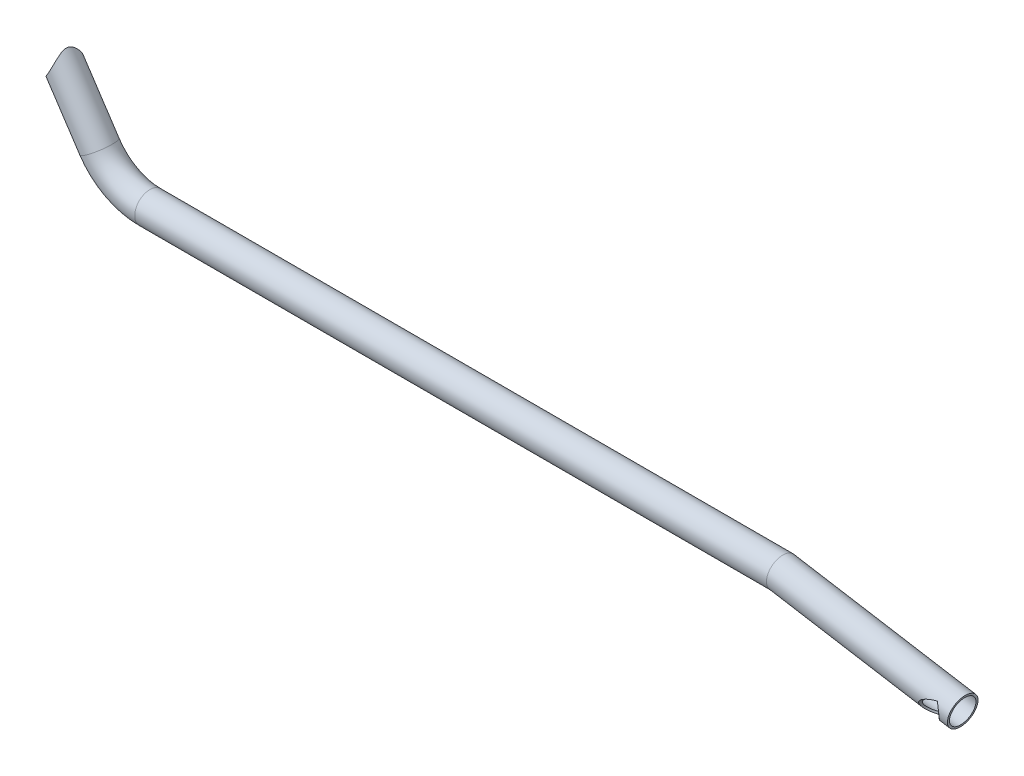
SolidWorks part; units mm, degrees
ref_plane "Plan de face" through (0, 0, 0) normal (0, 0, 1) x (1, 0, 0)
ref_plane "Plan de dessus" through (0, 0, 0) normal (0, 1, 0) x (1, 0, 0)
ref_plane "Plan de droite" through (0, 0, 0) normal (1, 0, 0) x (0, 0, -1)
sketch "Esquisse1" plane through (0, 0, 0) normal (0, 0, 1) x (1, 0, 0)
  line L0 (-442.83, 0) -> (-397.792, -68.0982)
  line L1 (-347.7469, -95) -> (280, -95)
  line L2 (280, -95) -> (460, -125)
  arc A1 (-397.792, -68.0982) -> (-347.7469, -95) centre (-347.7469, -35) ccw
  point P7 (-380, -95)
  dimension "D6" = 442.83
  dimension "D7" = 60
  dimension "D1" = 380
  dimension "D2" = 95
  dimension "D3" = 280
  dimension "D4" = 180
  dimension "D5" = 125
ref_plane "Plan1" through (460, -125, 0) normal (0.9864, -0.1644, 0) x (0, 0, -1)
sketch "Esquisse2" plane through (460, -125, 0) normal (0.9864, -0.1644, 0) x (0, 0, -1)
  circle A0 centre (0, 0) radius 15
  circle A1 centre (0, 0) radius 13
  dimension "D1" = 26
  dimension "D2" = 30
sweep "Balayage1" add profiles "Esquisse2" path "Esquisse1"
sketch "Esquisse3" plane through (-24.3152, -3.2825, 27.9414) normal (-0.6539, -0.0883, 0.7514) x (0.7564, -0.0534, 0.6519)
  circle A0 centre (355.0908, -136.5572) radius 15 construction
  circle A1 centre (355.0908, -136.5572) radius 15
extrude "Enlèv. mat.-Extru.1" cut sketch "Esquisse3" against normal blind 310
sketch "Esquisse4" plane through (-24.3556, 0, 134.8177) normal (-0.1778, 0, 0.9841) x (0.9841, 0, 0.1778)
  circle A0 centre (-450, 0) radius 30 construction
  circle A1 centre (-450, 0) radius 30
extrude "Enlèv. mat.-Extru.2" cut sketch "Esquisse4" against normal blind 110
